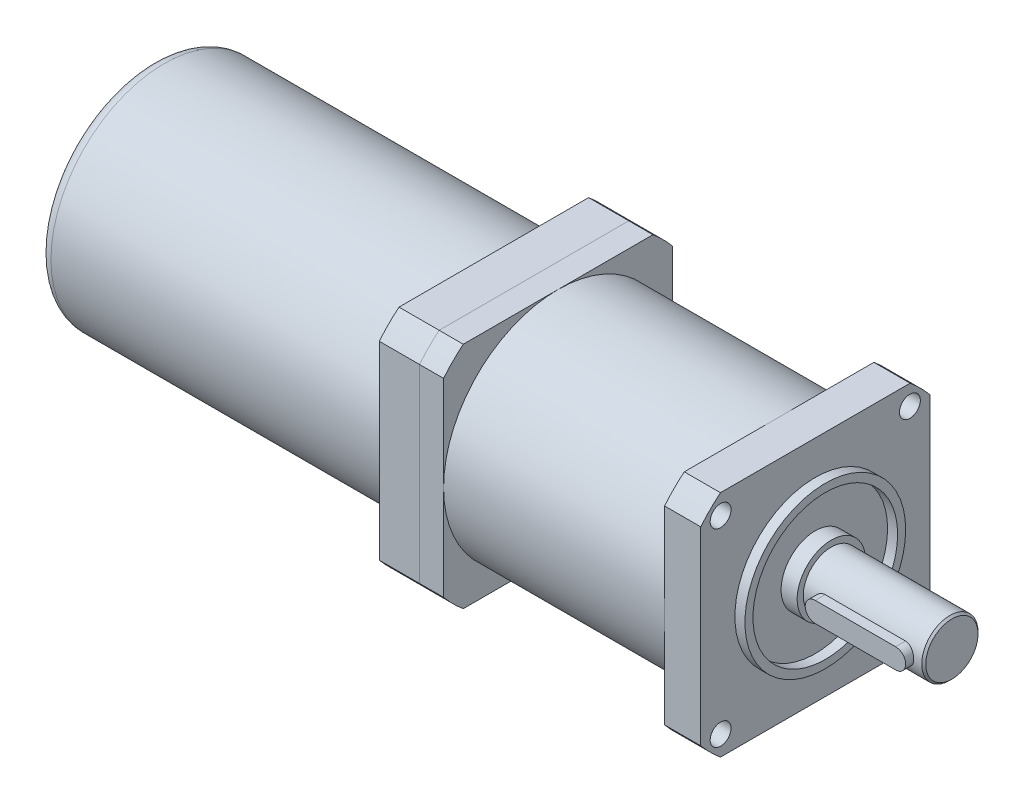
SolidWorks part; units mm, degrees
ref_plane "前视基准面" through (0, 0, 0) normal (0, 0, 1) x (1, 0, 0)
ref_plane "上视基准面" through (0, 0, 0) normal (0, 1, 0) x (1, 0, 0)
ref_plane "右视基准面" through (0, 0, 0) normal (1, 0, 0) x (0, 0, -1)
sketch "草图1" plane through (0, 0, 0) normal (1, 0, 0) x (0, 0, -1)
  line L1 (-23.5956, -28.5) -> (23.5956, -28.5)
  line L2 (-28.5, -23.5956) -> (-28.5, 23.5956)
  line L3 (-23.5956, 28.5) -> (23.5956, 28.5)
  line L4 (28.5, -23.5956) -> (28.5, 23.5956)
  line L5 (-26.163, -26.163) -> (26.163, 26.163) construction
  line L6 (-26.163, 26.163) -> (26.163, -26.163) construction
  arc A0 (-28.5, -23.5956) -> (-23.5956, -28.5) centre (0, 0) ccw
  arc A1 (-23.5956, 28.5) -> (-28.5, 23.5956) centre (0, 0) ccw
  arc A2 (28.5, 23.5956) -> (23.5956, 28.5) centre (0, 0) ccw
  arc A3 (23.5956, -28.5) -> (28.5, -23.5956) centre (0, 0) ccw
  point P0 (0, 0)
extrude "凸台-拉伸1" add sketch "草图1" against normal blind 9
sketch "草图2" plane through (-9, 0, 0) normal (-1, 0, 0) x (0, 0, 1)
  circle A0 centre (0, 0) radius 28.5
extrude "凸台-拉伸2" add sketch "草图2" along normal blind 55
sketch "草图3" plane through (-64, 0, 0) normal (-1, 0, 0) x (0, 0, 1)
  line L1 (-23.5956, -28.5) -> (23.5956, -28.5)
  line L2 (-28.5, -23.5956) -> (-28.5, 23.5956)
  line L3 (-23.5956, 28.5) -> (23.5956, 28.5)
  line L4 (28.5, -23.5956) -> (28.5, 23.5956)
  line L5 (-26.163, -26.163) -> (26.163, 26.163) construction
  line L6 (-26.163, 26.163) -> (26.163, -26.163) construction
  arc A0 (-28.5, -23.5956) -> (-23.5956, -28.5) centre (0, 0) ccw
  arc A1 (23.5956, -28.5) -> (28.5, -23.5956) centre (0, 0) ccw
  arc A2 (28.5, 23.5956) -> (23.5956, 28.5) centre (0, 0) ccw
  arc A3 (-23.5956, 28.5) -> (-28.5, 23.5956) centre (0, 0) ccw
  point P0 (0, 0)
extrude "凸台-拉伸3" add sketch "草图3" along normal blind 6
sketch "草图6" plane through (0, 0, 0) normal (1, 0, 0) x (0, 0, -1)
  circle A0 centre (-23.55, 23.55) radius 2.6
  circle A1 centre (23.55, 23.55) radius 2.6
  circle A2 centre (23.55, -23.55) radius 2.6
  circle A3 centre (-23.55, -23.55) radius 2.6
  point P0 (0, 0)
extrude "切除-拉伸2" cut sketch "草图6" against normal blind 9
sketch "草图7" plane through (0, 0, 0) normal (1, 0, 0) x (0, 0, -1)
  circle A0 centre (0, 0) radius 20
  circle A1 centre (0, 0) radius 18
extrude "凸台-拉伸5" add sketch "草图7" along normal blind 2.5
sketch "草图8" plane through (0, 0, 0) normal (1, 0, 0) x (0, 0, -1)
  circle A0 centre (0, 0) radius 8.5
extrude "凸台-拉伸6" add sketch "草图8" along normal blind 4
sketch "草图9" plane through (4, 0, 0) normal (1, 0, 0) x (0, 0, -1)
  circle A0 centre (0, 0) radius 7
extrude "凸台-拉伸7" add sketch "草图9" along normal blind 30
ref_plane "基准面1" through (0, 0, 7) normal (0, 0, 1) x (1, 0, 0)
sketch "草图10" plane through (0, 0, 7) normal (0, 0, 1) x (1, 0, 0)
  line L3 (9, 2.5) -> (29, 2.5)
  line L5 (29, -2.5) -> (9, -2.5)
  arc A0 (29, -2.5) -> (29, 2.5) centre (29, 0) ccw
  arc A1 (9, 2.5) -> (9, -2.5) centre (9, 0) ccw
extrude "切除-拉伸3" cut sketch "草图10" against normal blind 3
sketch "草图11" plane through (0, 0, 4) normal (0, 0, 1) x (1, 0, 0)
  line L0 (9, 2.5) -> (29, 2.5)
  line L2 (29, -2.5) -> (9, -2.5)
  arc A0 (9, 2.5) -> (9, -2.5) centre (9, 0) ccw
  arc A1 (29, -2.5) -> (29, 2.5) centre (29, 0) ccw
extrude "凸台-拉伸8" add sketch "草图11" along normal blind 5
chamfer "倒角1" distance 0.5 angle 45 1 edges at (34, 0, -7)
sketch "草图14" plane through (-70, 0, 0) normal (-1, 0, 0) x (0, 0, 1)
  line L1 (-23.5956, -28.5) -> (23.5956, -28.5)
  line L2 (-28.5, -23.5956) -> (-28.5, 23.5956)
  line L3 (-23.5956, 28.5) -> (23.5956, 28.5)
  line L4 (28.5, -23.5956) -> (28.5, 23.5956)
  line L5 (-26.163, -26.163) -> (26.163, 26.163) construction
  line L6 (-26.163, 26.163) -> (26.163, -26.163) construction
  arc A0 (-23.5956, 28.5) -> (-28.5, 23.5956) centre (0, 0) ccw
  arc A1 (-28.5, -23.5956) -> (-23.5956, -28.5) centre (0, 0) ccw
  arc A2 (23.5956, -28.5) -> (28.5, -23.5956) centre (0, 0) ccw
  arc A3 (28.5, 23.5956) -> (23.5956, 28.5) centre (0, 0) ccw
  point P0 (0, 0)
extrude "凸台-拉伸9" add sketch "草图14" along normal blind 10 separate body
sketch "草图15" plane through (-80, 0, 0) normal (-1, 0, 0) x (0, 0, 1)
  circle A0 centre (0, 0) radius 28.2
extrude "凸台-拉伸10" add sketch "草图15" along normal blind 85
fillet "圆角1" radius 3 1 edges at (-165, 0, 28.2)
